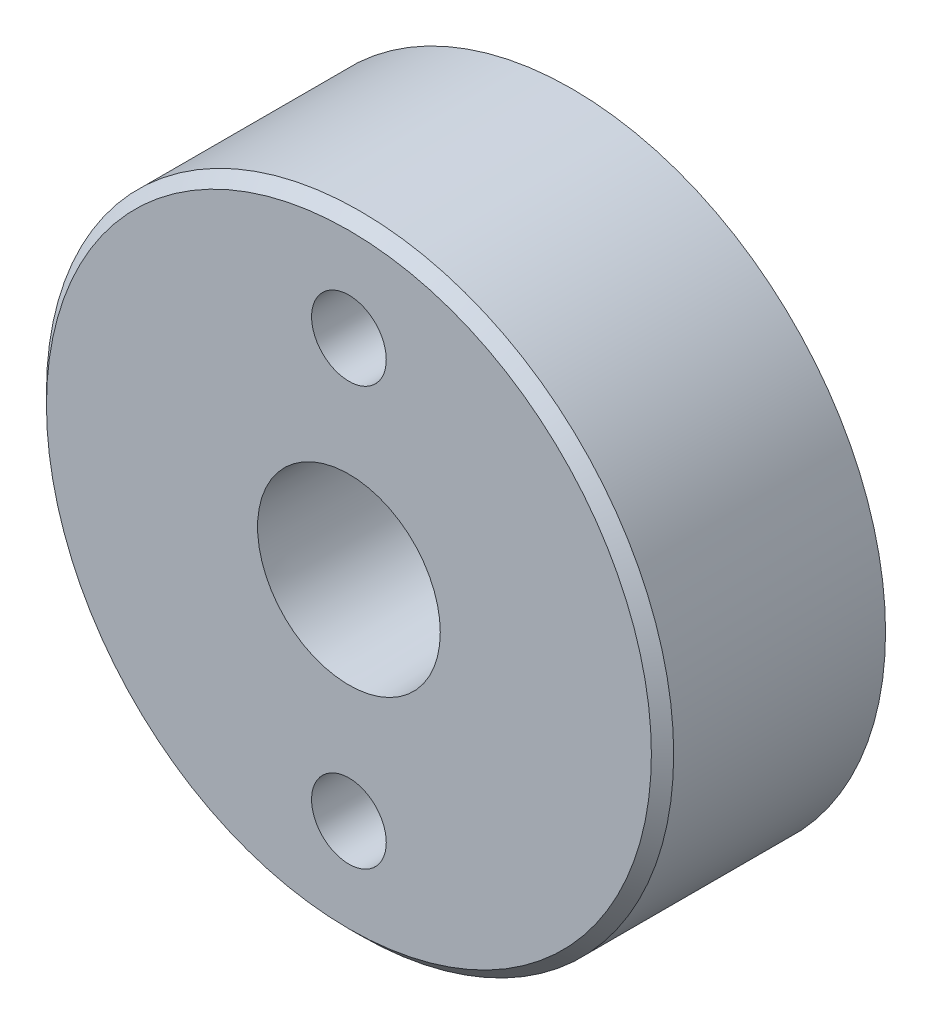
SolidWorks part; units mm, degrees
ref_plane "Front/Back" through (0, 0, 0) normal (0, 0, 1) x (1, 0, 0)
ref_plane "Top/Bottom" through (0, 0, 0) normal (0, 1, 0) x (1, 0, 0)
ref_plane "Right/Left" through (0, 0, 0) normal (1, 0, 0) x (0, 0, -1)
sketch "Sketch1" plane through (0, 0, 0) normal (0, 0, 1) x (1, 0, 0)
  circle A0 centre (0, 0) radius 21.4312
  dimension "D1" = 42.8625
extrude "Extrude1" add sketch "Sketch1" along normal mid plane 15.24
hole_wizard "1/4 NPT Tapped Hole1" positions "Sketch3" profile "Sketch2" size "1/4" standard "Ansi Inch"
sketch "Sketch3" plane through (0, 0, 7.62) normal (0, 0, 1) x (1, 0, 0)
  point P0 (0, 0)
sketch "Sketch2" plane through (0, 0, 7.62) normal (1, 0, 0) x (0, -1, 0)
  line L0 (0, 0) -> (0, 20.4111)
  line L1 (5.5626, 17.0688) -> (0, 20.4111)
  line L2 (-5.5626, 17.0688) -> (0, 20.4111) construction
  line L3 (5.5626, 17.0688) -> (5.5626, 10.0203)
  line L4 (5.5626, 10.0203) -> (5.9437, 10.0203)
  line L5 (5.9437, 10.0203) -> (6.2437, 0)
  line L6 (-5.9437, 10.0203) -> (-6.2437, 0) construction
  line L7 (6.2437, 0) -> (0, 0)
  line L8 (0, -6.35) -> (0, 107.95) construction
  line L11 (-5.5626, 10.0203) -> (-5.9437, 10.0203) construction
  dimension "Tap Drill Dia." = 11.1252
  dimension "Tap Drill Depth" = 17.0688
  dimension "Thread Dia." = 12.4874
  dimension "Thread Angle" = 3.43
  dimension "Thread Depth" = 10.0203
  dimension "Drill Angle" = 118
hole_wizard "#7 (0.201) Diameter Hole1" positions "Sketch5" profile "Sketch4" hole size "#7" standard "Ansi Inch"
sketch "Sketch5" plane through (0, 0, 7.62) normal (0, 0, 1) x (1, 0, 0)
  line L0 (0, 0) -> (0, 23.3492) construction
  line L1 (0, 0) -> (29.3718, 0) construction
  circle A0 centre (0, 0) radius 14.2875 construction
  point P0 (0, 14.2875)
  dimension "D1" = 28.575
sketch "Sketch4" plane through (0, 14.2875, 7.62) normal (1, 0, 0) x (0, -1, 0)
  line L0 (0, 0) -> (0, 9.1538)
  line L1 (0, 9.1538) -> (2.5527, 7.62)
  line L2 (2.5527, 7.62) -> (2.5527, 0)
  line L5 (2.5527, 0) -> (0, 0)
  line L10 (0, 9.1538) -> (-2.5527, 7.62) construction
  line L11 (0, -6.35) -> (0, 107.95) construction
  dimension "Hole Dia." = 5.1054
  dimension "Hole Depth" = 7.62
  dimension "Drill Angle" = 118
pattern_circular "CirPattern1" count 2 every 180 about axis through (0, 0, 0) along (0, 0, 1) of "#7 (0.201) Diameter Hole1"
chamfer "Chamfer1" distance 0.762 angle 45 1 edges at (21.4312, 0, 7.62)
